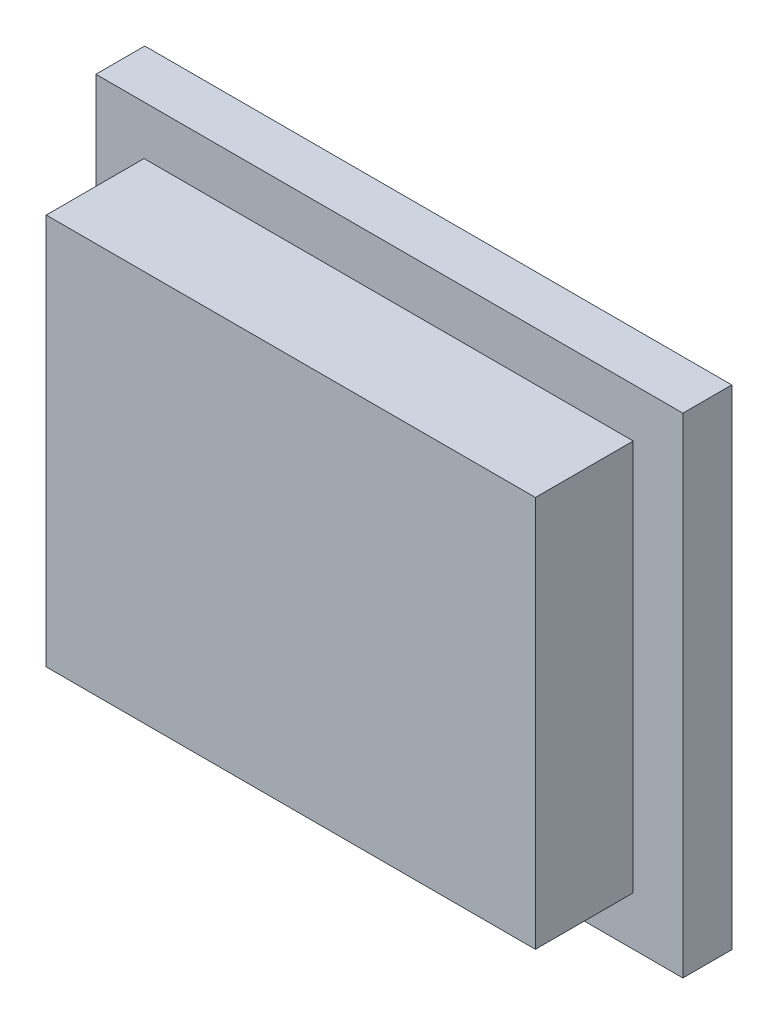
SolidWorks part; units mm, degrees
ref_plane "Alzado" through (0, 0, 0) normal (0, 0, 1) x (1, 0, 0)
ref_plane "Planta" through (0, 0, 0) normal (0, 1, 0) x (1, 0, 0)
ref_plane "Vista lateral" through (0, 0, 0) normal (1, 0, 0) x (0, 0, -1)
sketch "Croquis1" plane through (0, 0, 0) normal (0, 0, 1) x (1, 0, 0)
  line L1 (13.6011, -5.1072) -> (23.6011, -5.1072)
  line L2 (13.6011, -5.1072) -> (13.6011, -13.1072)
  line L3 (13.6011, -13.1072) -> (23.6011, -13.1072)
  line L4 (23.6011, -5.1072) -> (23.6011, -13.1072)
  line L5 (13.6011, -5.1072) -> (23.6011, -13.1072) construction
  line L6 (13.6011, -13.1072) -> (23.6011, -5.1072) construction
  point P0 (18.6011, -9.1072)
  dimension "D1" = 8
  dimension "D2" = 10
extrude "Saliente-Extruir1" add sketch "Croquis1" along normal blind 2
sketch "Croquis2" plane through (0, 0, 0) normal (0, 0, -1) x (-1, 0, 0)
  line L0 (-14.2704, -12.4676) -> (-13.6308, -13.1072) construction
  line L1 (-13.6011, -13.1072) -> (-23.6011, -13.1072) construction
  line L2 (-13.6308, -13.1072) -> (-23.6011, -5.1072) construction
  line L3 (-23.6011, -13.1072) -> (-23.6011, -5.1072) construction
  line L4 (-23.6011, -5.1072) -> (-23.6011, -13.1072) construction
  line L5 (-23.6011, -13.1072) -> (-13.6011, -5.1072) construction
  line L7 (-24.616, -4.1072) -> (-12.616, -4.1072)
  line L8 (-24.616, -4.1072) -> (-24.616, -14.1072)
  line L9 (-24.616, -14.1072) -> (-12.616, -14.1072)
  line L10 (-12.616, -4.1072) -> (-12.616, -14.1072)
  line L11 (-24.616, -4.1072) -> (-12.616, -14.1072) construction
  line L12 (-24.616, -14.1072) -> (-12.616, -4.1072) construction
  point P7 (-18.616, -9.1072)
  point P12 (-18.616, -9.1072)
  dimension "D1" = 12
  dimension "D2" = 10
extrude "Saliente-Extruir2" add sketch "Croquis2" along normal blind 1
